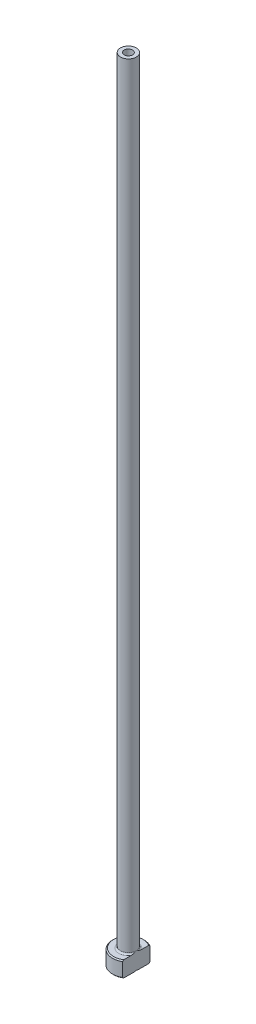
SolidWorks part; units mm, degrees
ref_plane "Front Plane" through (0, 0, 0) normal (0, 0, 1) x (1, 0, 0)
ref_plane "Top Plane" through (0, 0, 0) normal (0, 1, 0) x (1, 0, 0)
ref_plane "Right Plane" through (0, 0, 0) normal (1, 0, 0) x (0, 0, -1)
sketch "Sketch1" plane through (0, 0, 0) normal (0, 0, 1) x (1, 0, 0)
  line L0 (-0.8, 150) -> (-1.5, 150)
  line L1 (-1.5, 150) -> (-1.5, 3)
  line L2 (-1.5, 3) -> (-3, 3)
  line L3 (-3, 3) -> (-3, 0)
  line L4 (2.475, 0) -> (-2.475, 0) construction
  line L5 (-3, 0) -> (-1.05, 0)
  line L6 (-0.8, 115) -> (-0.8, 150)
  line L7 (0, 92.1877) -> (0, -15.5353) construction
  line L8 (0, -3.3) -> (0, 3.3) construction
  line L9 (-0.8, 115) -> (-1.05, 103)
  line L10 (-1.05, 103) -> (-1.05, 0)
  dimension "D1" = 0.25
  dimension "ID" = 1.6
  dimension "OD" = 3
  dimension "L" = 150
  dimension "H" = 6
  dimension "T" = 3
  dimension "N" = 35
  dimension "D2" = 12
  dimension "L-N" = 115
revolve "Revolve1" add sketch "Sketch1" angle 360 about L7
fillet "Fillet1" radius 0.3 1 edges at (0, 3, 1.5)
chamfer "Chamfer1" distance 0.2 angle 45 2 edges at (0, 3, 3) (0, 0, 3)
sketch "Sketch2" plane through (0, 0, 0) normal (0, -1, 0) x (1, 0, 0)
  line L0 (1.5, 2.5981) -> (1.5, -2.5981)
  circle A0 centre (0, 0) radius 3 construction
  arc A1 (1.5, 2.5981) -> (1.5, -2.5981) centre (0, 0) cw
  circle A2 centre (0, 0) radius 1.5 construction
extrude "Cut-Extrude1" cut sketch "Sketch2" against normal through all
chamfer "Chamfer2" distance 0.5 angle 45 1 edges at (0, 0, 1.05)
